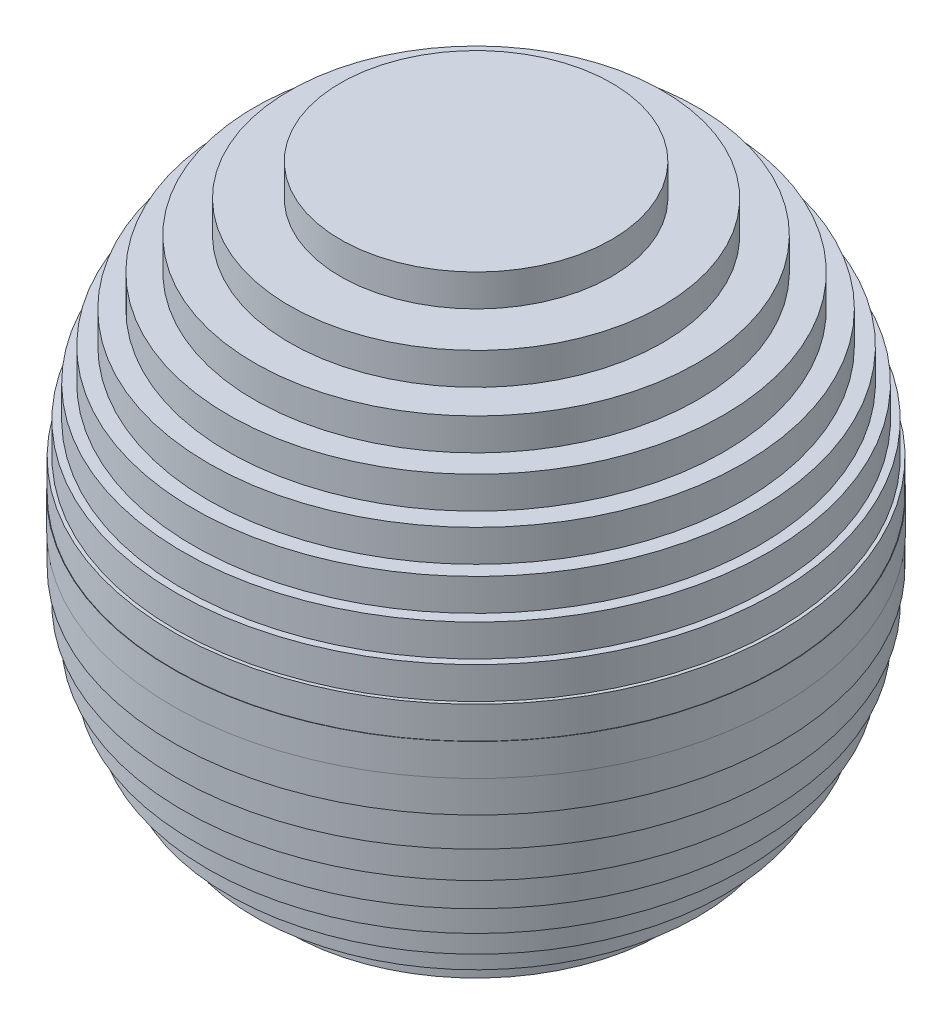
SolidWorks part; units mm, degrees
ref_plane "Front Plane" through (0, 0, 0) normal (0, 0, 1) x (1, 0, 0)
ref_plane "Top Plane" through (0, 0, 0) normal (0, 1, 0) x (1, 0, 0)
ref_plane "Right Plane" through (0, 0, 0) normal (1, 0, 0) x (0, 0, -1)
sketch "Sketch1" plane through (0, 0, 0) normal (0, 0, 1) x (1, 0, 0)
  line L0 (0, -47.5) -> (0, 47.5) construction
  line L1 (0, -47.5) -> (47.5, -47.5) construction
  line L2 (0, -42.5) -> (47.5, -42.5) construction
  line L3 (0, -37.5) -> (47.5, -37.5) construction
  line L4 (0, -32.5) -> (47.5, -32.5) construction
  line L5 (0, -27.5) -> (47.5, -27.5) construction
  line L6 (0, -22.5) -> (47.5, -22.5) construction
  line L7 (0, -17.5) -> (47.5, -17.5) construction
  line L35 (0, -12.5) -> (47.5, -12.5) construction
  line L36 (0, -7.5) -> (47.5, -7.5) construction
  line L37 (0, -2.5) -> (47.5, -2.5) construction
  line L38 (0, 2.5) -> (47.5, 2.5) construction
  line L39 (0, 7.5) -> (47.5, 7.5) construction
  line L40 (0, 12.5) -> (47.5, 12.5) construction
  line L41 (0, 17.5) -> (47.5, 17.5) construction
  line L42 (0, 22.5) -> (47.5, 22.5) construction
  line L43 (0, 27.5) -> (47.5, 27.5) construction
  line L44 (0, 32.5) -> (47.5, 32.5) construction
  line L45 (0, 37.5) -> (47.5, 37.5) construction
  line L46 (0, 42.5) -> (47.5, 42.5) construction
  arc A0 (0, 47.5) -> (0, -47.5) centre (0, 0) cw construction
  point P4 (0, 0)
  point P7 (47.5, 0)
  point P8 (0, 47.5)
sketch "Sketch4" plane through (0, 0, 0) normal (0, 0, 1) x (1, 0, 0)
  line L0 (47.5, 2.5) -> (47.5, -2.5)
  line L1 (47.5, -2.5) -> (47.4342, -2.5)
  line L2 (0, -2.5) -> (47.5, -2.5) construction
  line L3 (47.4342, -2.5) -> (47.4342, -7.5)
  line L4 (0, -7.5) -> (47.5, -7.5) construction
  line L5 (47.4342, -7.5) -> (46.9042, -7.5)
  line L6 (46.9042, -7.5) -> (46.9042, -12.5)
  line L7 (0, -12.5) -> (47.5, -12.5) construction
  line L8 (46.9042, -12.5) -> (45.8258, -12.5)
  line L9 (45.8258, -12.5) -> (45.8258, -17.5)
  line L10 (0, -17.5) -> (47.5, -17.5) construction
  line L11 (45.8258, -17.5) -> (44.1588, -17.5)
  line L12 (44.1588, -17.5) -> (44.1588, -22.5)
  line L13 (0, -22.5) -> (47.5, -22.5) construction
  line L14 (44.1588, -22.5) -> (41.833, -22.5)
  line L15 (41.833, -22.5) -> (41.833, -27.5)
  line L16 (0, -27.5) -> (47.5, -27.5) construction
  line L17 (41.833, -27.5) -> (38.7298, -27.5)
  line L18 (38.7298, -27.5) -> (38.7298, -32.5)
  line L19 (0, -32.5) -> (47.5, -32.5) construction
  line L20 (38.7298, -32.5) -> (34.641, -32.5)
  line L21 (34.641, -32.5) -> (34.641, -37.5)
  line L22 (0, -37.5) -> (47.5, -37.5) construction
  line L23 (34.641, -37.5) -> (29.1548, -37.5)
  line L24 (29.1548, -37.5) -> (29.1548, -42.5)
  line L25 (0, -42.5) -> (47.5, -42.5) construction
  line L26 (29.1548, -42.5) -> (21.2132, -42.5)
  line L27 (21.2132, -42.5) -> (21.2132, -47.5)
  line L28 (0, -47.5) -> (47.5, -47.5) construction
  line L29 (21.2132, -47.5) -> (0, -47.5)
  line L30 (0, -47.5) -> (0, 47.5)
  line L31 (0, 47.5) -> (21.2132, 47.5)
  line L32 (21.2132, 47.5) -> (21.2132, 42.5)
  line L33 (0, 42.5) -> (47.5, 42.5) construction
  line L34 (21.2132, 42.5) -> (29.1548, 42.5)
  line L35 (29.1548, 42.5) -> (29.1548, 37.5)
  line L36 (0, 37.5) -> (47.5, 37.5) construction
  line L37 (29.1548, 37.5) -> (34.641, 37.5)
  line L38 (34.641, 37.5) -> (34.641, 32.5)
  line L39 (0, 32.5) -> (47.5, 32.5) construction
  line L40 (34.641, 32.5) -> (38.7298, 32.5)
  line L41 (38.7298, 32.5) -> (38.7298, 27.5)
  line L42 (0, 27.5) -> (47.5, 27.5) construction
  line L43 (38.7298, 27.5) -> (41.833, 27.5)
  line L44 (41.833, 27.5) -> (41.833, 22.5)
  line L45 (0, 22.5) -> (47.5, 22.5) construction
  line L46 (41.833, 22.5) -> (44.1588, 22.5)
  line L47 (44.1588, 22.5) -> (44.1588, 17.5)
  line L48 (0, 17.5) -> (47.5, 17.5) construction
  line L49 (44.1588, 17.5) -> (45.8258, 17.5)
  line L50 (45.8258, 17.5) -> (45.8258, 12.5)
  line L51 (0, 12.5) -> (47.5, 12.5) construction
  line L52 (45.8258, 12.5) -> (46.9042, 12.5)
  line L53 (46.9042, 12.5) -> (46.9042, 7.5)
  line L54 (0, 7.5) -> (47.5, 7.5) construction
  line L55 (46.9042, 7.5) -> (47.4342, 7.5)
  line L56 (47.4342, 7.5) -> (47.4342, 2.5)
  line L57 (0, 2.5) -> (47.5, 2.5) construction
  line L58 (47.4342, 2.5) -> (47.5, 2.5)
  arc A0 (0, -47.5) -> (0, 47.5) centre (0, 0) ccw construction
revolve "Revolve4" add sketch "Sketch4" angle 360 about L30
equation "\"Ball Diameter\"= \"Layers\" * \"Layer Height\""
equation "\"Layers\"= 19"
equation "\"D1@Sketch1\"=\"Ball Diameter\""
equation "\"Layer Height\"= 5mm"
equation "\"D3@Sketch1\"=\"Layer Height\""
equation "\"D2@Sketch1\"=\"Layers\""
